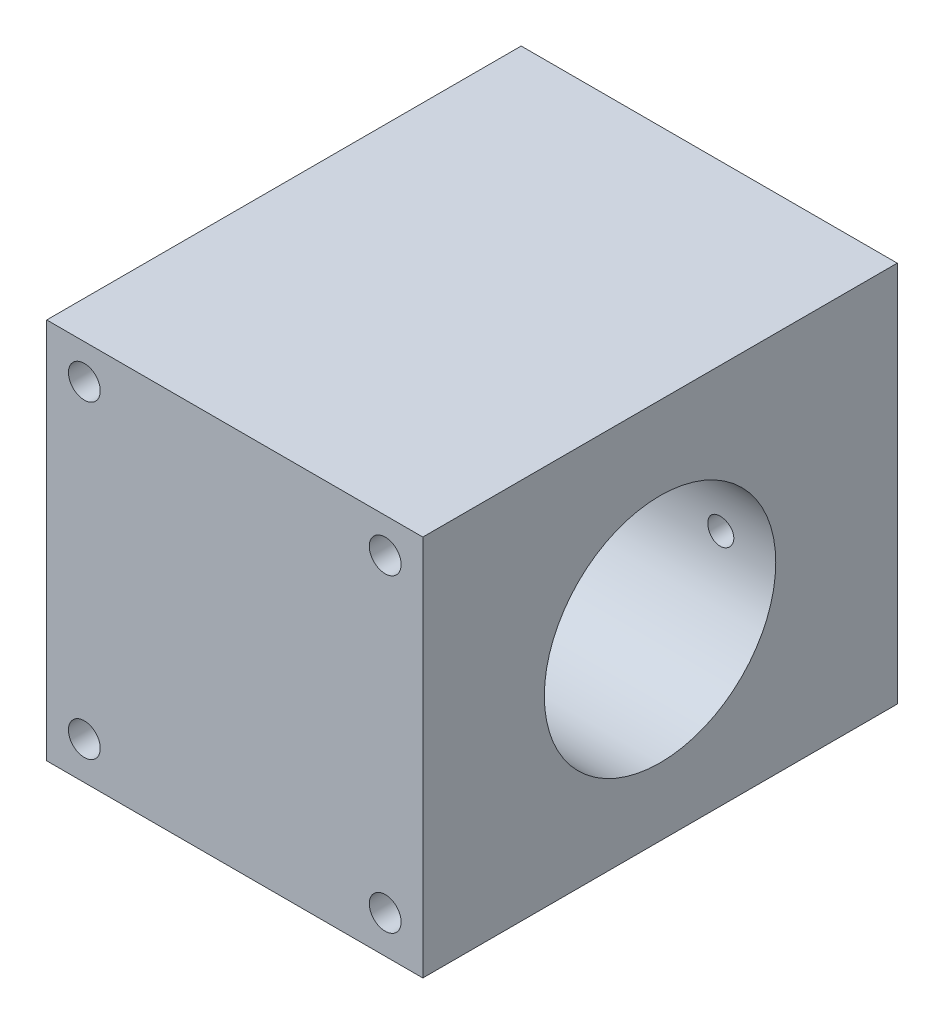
SolidWorks part; units mm, degrees
ref_plane "前视基准面" through (0, 0, 0) normal (0, 0, 1) x (1, 0, 0)
ref_plane "上视基准面" through (0, 0, 0) normal (0, 1, 0) x (1, 0, 0)
ref_plane "右视基准面" through (0, 0, 0) normal (1, 0, 0) x (0, 0, -1)
sketch "草图1" plane through (0, 0, 0) normal (0, 0, 1) x (1, 0, 0)
  line L1 (0, 0) -> (65, 0)
  line L2 (0, 0) -> (0, 66)
  line L3 (0, 66) -> (65, 66)
  line L4 (65, 0) -> (65, 66)
  dimension "D1" = 65
  dimension "D2" = 66
extrude "凸台-拉伸1" add sketch "草图1" along normal blind 82
hole_wizard "打孔尺寸(%根据)内六角圆柱头螺钉的类型1" positions "草图3" profile "草图4" counterbore size "M5" standard "GB"
sketch "草图3" plane through (0, 0, 0) normal (0, 0, -1) x (-1, 0, 0)
  line L0 (-32.5, 0) -> (-32.5, 66) construction
  line L1 (0, 0) -> (-65, 0) construction
  line L2 (-65, 66) -> (0, 66) construction
  point P0 (-58.5, 6.5)
  point P2 (-6.5, 6.5)
  point P11 (-58.5, 60)
  point P13 (-6.5, 60)
  dimension "D1" = 52
  dimension "D2" = 6.5
  dimension "D3" = 53.5
sketch "草图4" plane through (58.5, 6.5, 0) normal (1, 0, 0) x (0, 1, 0)
  line L0 (0, 0) -> (0, 82)
  line L1 (0, 82) -> (2.75, 82)
  line L3 (2.75, 82) -> (2.75, 50)
  line L4 (2.75, 50) -> (4.8, 50)
  line L5 (4.8, 50) -> (4.8, 0)
  line L7 (4.8, 0) -> (0, 0)
  line L11 (0, -6.35) -> (0, 107.95) construction
  dimension "通孔孔直径" = 5.5
  dimension "通孔孔深度" = 82
  dimension "柱形沉头孔直径" = 9.6
  dimension "柱形沉头孔深度" = 50
hole_wizard "打孔尺寸(%根据)内六角圆柱头螺钉的类型2" positions "草图13" profile "草图14" counterbore size "M4" standard "GB"
sketch "草图13" plane through (0, 0, 0) normal (0, 0, -1) x (-1, 0, 0)
  line L0 (-32.5, 0) -> (-32.5, 96.9471) construction
  line L1 (0, 0) -> (-65, 0) construction
  point P0 (-55.5, 31.7)
  point P2 (-9.5, 31.7)
  dimension "D1" = 31.7
  dimension "D2" = 46
sketch "草图14" plane through (55.5, 31.7, 0) normal (1, 0, 0) x (0, 1, 0)
  line L0 (0, 0) -> (0, 41.3519)
  line L1 (0, 41.3519) -> (2.25, 40)
  line L2 (2.25, 40) -> (2.25, 5)
  line L3 (2.25, 5) -> (4, 5)
  line L4 (4, 5) -> (4, 0)
  line L5 (4, 0) -> (0, 0)
  line L10 (0, 41.3519) -> (-2.25, 40) construction
  line L11 (0, -6.35) -> (0, 107.95) construction
  dimension "孔直径" = 4.5
  dimension "孔深度" = 40
  dimension "柱形沉头孔直径" = 8
  dimension "柱形沉头孔深度" = 5
  dimension "导头角度" = 118
ref_plane "基准面1" through (32.5, 0, 0) normal (-1, 0, 0) x (0, 0, 1)
sketch "草图28" plane through (0, 0, 0) normal (0, 0, -1) x (-1, 0, 0)
  line L0 (-40.9745, 44.6274) -> (-38.8991, 40.6913)
  line L1 (-38.8991, 40.6913) -> (-44.2383, 40.6913)
  line L2 (-44.2383, 40.6913) -> (-45.7, 43.7935)
  line L3 (-45.7, 43.7935) -> (-46.8484, 46.231)
  line L4 (-45.0425, 48.1261) -> (-46.9195, 48.1261)
  line L5 (-49.1038, 40.6913) -> (-54.2426, 40.6913)
  line L6 (-54.2426, 40.6913) -> (-51.4924, 50.0942)
  line L7 (-51.4924, 50.0942) -> (-43.6202, 50.0942)
  line L8 (-20.4992, 53.437) -> (-22.4845, 51.3584)
  line L9 (-17.5443, 53.437) -> (-20.4992, 53.437)
  line L10 (-19.6013, 51.2808) -> (-17.5443, 53.437)
  line L11 (-22.4597, 51.2808) -> (-19.6013, 51.2808)
  line L12 (-22.4845, 51.3584) -> (-22.4597, 51.2808)
  line L13 (-20.0279, 54.7191) -> (-21.5055, 54.7191)
  line L14 (-21.0565, 53.641) -> (-20.0279, 54.7191)
  line L15 (-22.534, 53.641) -> (-21.0565, 53.641)
  line L16 (-21.5055, 54.7191) -> (-22.534, 53.641)
  line L17 (-23.1746, 53.2206) -> (-24.9126, 53.2206)
  line L18 (-24.3844, 51.9524) -> (-23.1746, 53.2206)
  line L19 (-26.1225, 51.9524) -> (-24.3844, 51.9524)
  line L20 (-24.9126, 53.2206) -> (-26.1225, 51.9524)
  line L21 (-31.083, 46.6764) -> (-28.9157, 43.9746)
  line L22 (-28.9157, 43.9746) -> (-29.8668, 40.6913)
  line L23 (-29.8668, 40.6913) -> (-35.1332, 40.6913)
  line L24 (-35.1332, 40.6913) -> (-34.0307, 44.5676)
  line L25 (-34.0307, 44.5676) -> (-38.2325, 50.0942)
  line L26 (-38.2325, 50.0942) -> (-33.8247, 50.0942)
  line L27 (-33.8247, 50.0942) -> (-31.083, 46.6764)
  line L28 (-16.165, 43.3612) -> (-12.6899, 45.7511)
  line L29 (-12.6899, 45.7511) -> (-9.5773, 40.6731)
  line L30 (-9.5773, 40.6731) -> (-14.862, 40.6731)
  line L31 (-14.862, 40.6731) -> (-16.165, 43.3612)
  line L32 (-26.6903, 51.2808) -> (-22.5587, 51.2808)
  line L33 (-22.5587, 51.2808) -> (-28.7797, 44.444)
  line L34 (-28.7797, 44.444) -> (-30.8045, 46.9682)
  line L35 (-30.8045, 46.9682) -> (-26.6903, 51.2808)
  line L36 (-20.0971, 41.5341) -> (-20.3469, 40.6731)
  line L37 (-20.3469, 40.6731) -> (-25.3218, 40.6731)
  line L38 (-25.3218, 40.6731) -> (-22.5902, 50.0942)
  line L39 (-22.5902, 50.0942) -> (-17.5972, 50.0942)
  line L40 (-17.5972, 50.0942) -> (-18.8643, 45.7754)
  line L41 (-18.8643, 45.7754) -> (-12.1979, 50.0942)
  line L42 (-12.1979, 50.0942) -> (-7.2468, 50.0942)
  spline S0 degree 3 poles (-46.8484, 46.231) (-45.8406, 46.231) (-42.525, 46.0196) (-42.5592, 47.2697) knots 0.230769 0.230769 0.230769 0.230769 0.307692 0.307692 0.307692 0.307692
  spline S1 degree 3 poles (-42.5592, 47.2697) (-42.5747, 47.8406) (-43.4025, 48.1261) (-45.0425, 48.1261) knots 0.307692 0.307692 0.307692 0.307692 0.384615 0.384615 0.384615 0.384615
  spline S2 degree 3 poles (-46.9195, 48.1261) (-47.6608, 45.6522) (-48.3749, 43.1693) (-49.1038, 40.6913) knots 0.461538 0.461538 0.461538 0.461538 0.538462 0.538462 0.538462 0.538462
  spline S3 degree 3 poles (-43.6202, 50.0942) (-41.4821, 50.0942) (-39.8931, 49.8512) (-38.8534, 49.3653) knots 0.769231 0.769231 0.769231 0.769231 0.846154 0.846154 0.846154 0.846154
  spline S4 degree 3 poles (-37.2593, 47.379) (-37.2225, 46.0305) (-38.4609, 45.1133) (-40.9745, 44.6274) knots 0.923077 0.923077 0.923077 0.923077 1 1 1 1
  spline S5 degree 3 poles (-38.8534, 49.3653) (-37.8136, 48.8794) (-37.2822, 48.2172) (-37.2593, 47.379) knots 0.846154 0.846154 0.846154 0.846154 0.923077 0.923077 0.923077 0.923077
  spline S6 degree 3 poles (-7.2468, 50.0942) (-11.6098, 47.4602) (-15.8435, 44.041) (-20.0971, 41.5341) knots 0.875 0.875 0.875 0.875 1 1 1 1
extrude "切除-拉伸13" cut sketch "草图28" against normal blind 0.2
sketch "草图29" plane through (65, 0, 0) normal (1, 0, 0) x (0, 0, -1)
  line L0 (-82, 31.7) -> (0, 31.7) construction
  line L3 (-82, 0) -> (-82, 66) construction
  line L4 (0, 0) -> (0, 66) construction
  line L5 (-82, 0) -> (0, 0) construction
  circle A0 centre (-41, 31.7) radius 20
  point P10 (-41, 31.7)
  dimension "D2" = 40
  dimension "D1" = 31.7
extrude "切除-拉伸14" cut sketch "草图29" against normal through all
other "冻结***"
